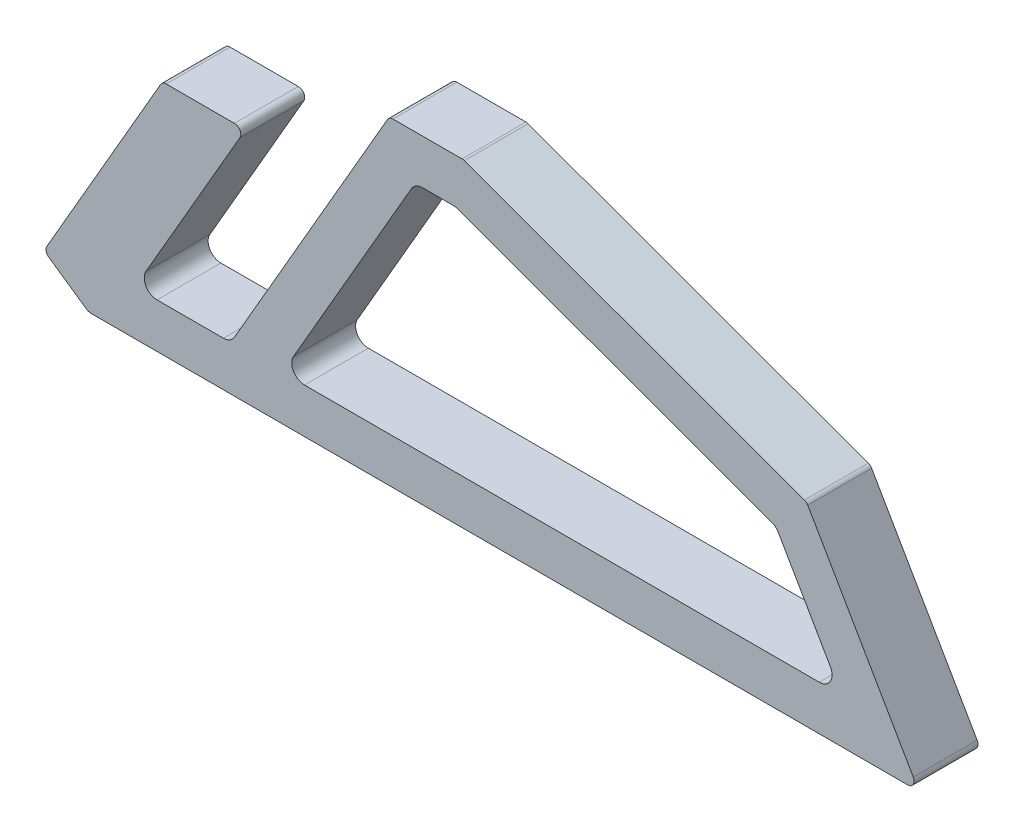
SolidWorks part; units mm, degrees
ref_plane "Front Plane" through (0, 0, 0) normal (0, 0, 1) x (1, 0, 0)
ref_plane "Top Plane" through (0, 0, 0) normal (0, 1, 0) x (1, 0, 0)
ref_plane "Right Plane" through (0, 0, 0) normal (1, 0, 0) x (0, 0, -1)
sketch "Sketch1" plane through (0, 0, 0) normal (0, 0, 1) x (1, 0, 0)
  line L0 (0, 0) -> (130, 0)
  line L1 (130, 0) -> (112.4333, 30.4265)
  line L2 (112.4333, 30.4265) -> (58.6555, 50)
  line L3 (47.0847, 50) -> (22.2586, 7)
  line L5 (-7, 4.8392) -> (11.568, 37)
  line L6 (11.568, 37) -> (24.568, 37)
  line L7 (24.568, 37) -> (7.2475, 7)
  line L8 (22.2586, 7) -> (7.2475, 7)
  line L9 (47.0847, 50) -> (58.6555, 50)
  line L10 (107.645, 24.72) -> (57.4212, 43)
  line L11 (51.1261, 43) -> (57.4212, 43)
  line L12 (51.1261, 43) -> (30.3415, 7)
  line L13 (30.3415, 7) -> (30.3415, 7)
  line L14 (30.3415, 7) -> (30.3415, 7)
  line L15 (30.3415, 7) -> (30.3415, 7)
  line L16 (30.3415, 7) -> (30.3415, 7)
  line L17 (30.3415, 7) -> (30.3415, 7)
  line L18 (30.3415, 7) -> (117.8756, 7)
  line L19 (117.8756, 7) -> (107.645, 24.72)
  line L20 (0, 0) -> (-7, 4.8392) construction
  line L21 (-7, 4.8392) -> (0, 0)
  dimension "D1" = 130
  dimension "D2" = 60
  dimension "D3" = 13
  dimension "D4" = 13
  dimension "D5" = 7
  dimension "D6" = 60
  dimension "D8" = 7
  dimension "D9" = 30
  dimension "D10" = 140
  dimension "D11" = 13
  dimension "D7" = 7
extrude "Boss-Extrude1" add sketch "Sketch1" along normal blind 10
fillet "Fillet1" radius 2 7 edges at (7.2475, 7, 5) (22.2586, 7, 5) (107.645, 24.72, 5) (30.3415, 7, 5) (117.8756, 7, 5) (51.1261, 43, 5) (57.4212, 43, 5)
fillet "Fillet2" radius 1 8 edges at (-7, 4.8392, 5) (47.0847, 50, 5) (58.6555, 50, 5) (112.4333, 30.4265, 5) (130, 0, 5) (0, 0, 5) (24.568, 37, 5) (11.568, 37, 5)
